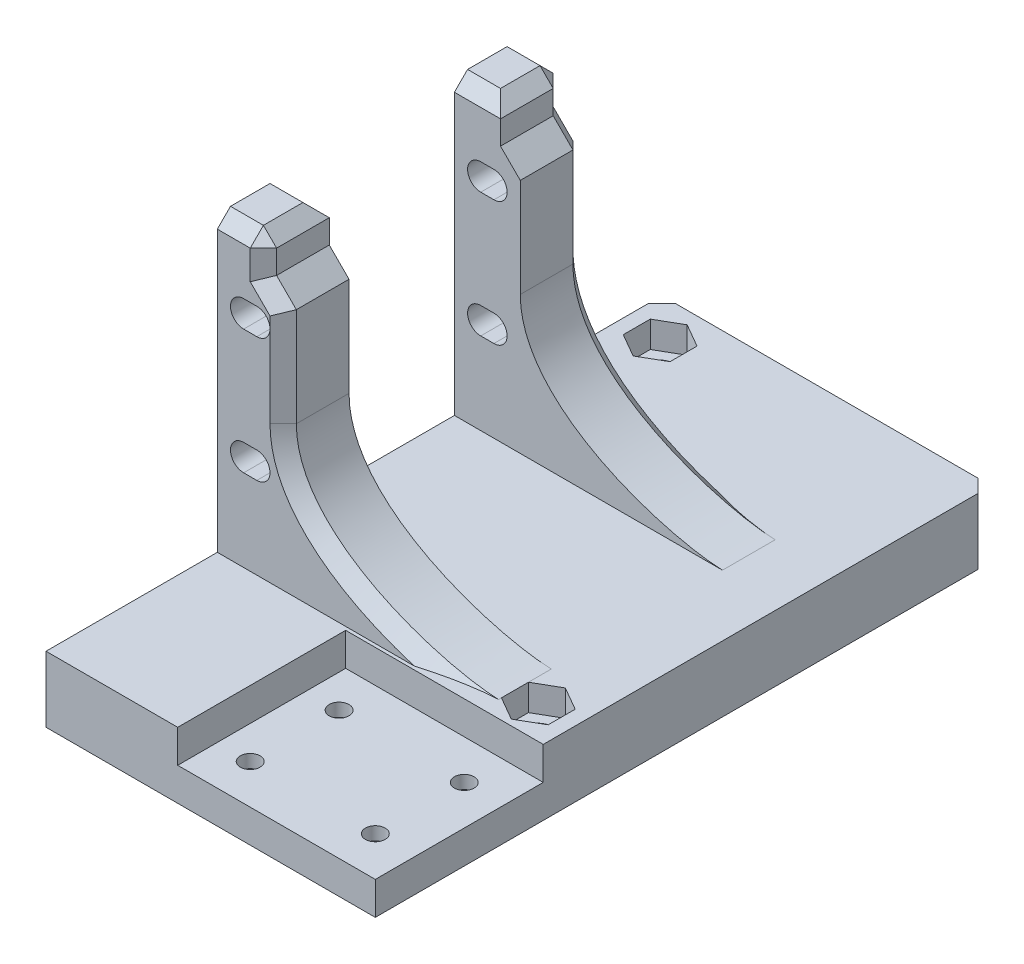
SolidWorks part; units mm, degrees
ref_plane "Front Plane" through (0, 0, 0) normal (0, 0, 1) x (1, 0, 0)
ref_plane "Top Plane" through (0, 0, 0) normal (0, 1, 0) x (1, 0, 0)
ref_plane "Right Plane" through (0, 0, 0) normal (1, 0, 0) x (0, 0, -1)
sketch "Sketch1" plane through (0, 0, 0) normal (0, 1, 0) x (1, 0, 0)
  line L1 (-25, -44.5) -> (25, -44.5)
  line L2 (-25, -44.5) -> (-25, 44.5)
  line L3 (-25, 44.5) -> (25, 44.5)
  line L4 (25, -44.5) -> (25, 44.5)
  line L5 (-25, -44.5) -> (25, 44.5) construction
  line L6 (-25, 44.5) -> (25, -44.5) construction
  point P0 (0, 0)
  dimension "D1" = 89
  dimension "D2" = 50
extrude "Boss-Extrude1" add sketch "Sketch1" along normal blind 10
sketch "Sketch8" plane through (0, 0, 0) normal (0, -1, 0) x (1, 0, 0)
  circle A0 centre (-19.25, -38.4881) radius 2
  circle A1 centre (19.25, 18.5119) radius 2
  dimension "D1" = 4
  dimension "D2" = 4
extrude "Cut-Extrude3" cut sketch "Sketch8" against normal through all
sketch "Sketch9" plane through (0, 10, 0) normal (0, 1, 0) x (1, 0, 0)
  line L0 (-25, 44.5) -> (-25, -44.5) construction
  line L1 (-22.8, 40.5377) -> (-22.8, 36.4385)
  line L2 (-22.8, 36.4385) -> (-19.25, 34.3889)
  line L3 (-19.25, 34.3889) -> (-15.7, 36.4385)
  line L4 (-15.7, 36.4385) -> (-15.7, 40.5377)
  line L5 (-15.7, 40.5377) -> (-19.25, 42.5873)
  line L6 (-19.25, 42.5873) -> (-22.8, 40.5377)
  line L7 (25, -44.5) -> (25, 44.5) construction
  line L8 (22.8, -20.5615) -> (22.8, -16.4623)
  line L9 (22.8, -16.4623) -> (19.25, -14.4127)
  line L10 (19.25, -14.4127) -> (15.7, -16.4623)
  line L11 (15.7, -16.4623) -> (15.7, -20.5615)
  line L12 (15.7, -20.5615) -> (19.25, -22.6111)
  line L13 (19.25, -22.6111) -> (22.8, -20.5615)
  circle A0 centre (-19.25, 38.4881) radius 3.55 construction
  circle A1 centre (19.25, -18.5119) radius 3.55 construction
  dimension "D1" = 7.1
  dimension "D2" = 7.1
extrude "Cut-Extrude4" cut sketch "Sketch9" against normal blind 4
chamfer "Chamfer1" distance 2 angle 45 2 edges at (25, 5, -44.5) (-25, 5, -44.5)
ref_plane "Plane1" through (0, 0, -23) normal (0, 0, -1) x (-1, 0, 0)
sketch "Sketch11" plane through (0, 0, -23) normal (0, 0, -1) x (-1, 0, 0)
  line L0 (25, 10) -> (-15.7, 10)
  line L1 (25, 10) -> (25, 54.5)
  line L3 (15, 45.9078) -> (18, 48.9078)
  line L4 (15, 45.9078) -> (15, 30.9078)
  line L5 (18, 48.9078) -> (18, 54.5)
  line L6 (18, 54.5) -> (25, 54.5)
  line L7 (15, 21.9078) -> (15, 45.9078) construction
  line L8 (25, 67.9061) -> (25, 47.5789) construction
  spline S0 degree 3 poles (15, 30.9078) (15, 16.9598) (-6.6957, 10.3394) (-15.7, 10) knots 0 0 0 0 1 1 1 1
  dimension "D1" = 15
  dimension "D2" = 44.5
extrude "Boss-Extrude2" add sketch "Sketch11" against normal blind 10
sketch "Sketch12" plane through (0, 0, -13) normal (0, 0, 1) x (1, 0, 0)
  line L0 (-18, 43.3578) -> (-22, 43.3578) construction
  line L1 (-18, 24.4578) -> (-22, 24.4578) construction
  line L2 (-21, 46.9078) -> (-21, 39.8078) construction
  line L3 (-17.9504, 46.9078) -> (-22.0496, 46.9078) construction
  line L4 (-22.0496, 39.8078) -> (-17.9504, 39.8078) construction
  line L5 (-19, 46.9078) -> (-19, 39.8078) construction
  line L6 (-19, 41.3578) -> (-21, 41.3578)
  line L7 (-19, 45.3578) -> (-21, 45.3578)
  line L8 (-20, 39.8078) -> (-20, 28.0078) construction
  line L9 (-17.9504, 28.0078) -> (-22.0496, 28.0078) construction
  line L10 (-20, 33.9078) -> (-15, 33.9078) construction
  line L11 (-15, 45.9078) -> (-15, 30.9078) construction
  line L12 (-19, 26.4578) -> (-21, 26.4578)
  line L15 (-19, 22.4578) -> (-21, 22.4578)
  circle A1 centre (-20, 43.3578) radius 2 construction
  circle A2 centre (-20, 24.4578) radius 2 construction
  arc A3 (-21, 41.3578) -> (-21, 45.3578) centre (-21, 43.3578) cw
  arc A4 (-19, 45.3578) -> (-19, 41.3578) centre (-19, 43.3578) cw
  arc A7 (-19, 22.4578) -> (-19, 26.4578) centre (-19, 24.4578) ccw
  arc A8 (-21, 26.4578) -> (-21, 22.4578) centre (-21, 24.4578) ccw
  point P16 (-20, 43.3578)
  dimension "D1" = 1
  dimension "D3" = 2
  dimension "D4" = 2
  dimension "D2" = 1
extrude "Cut-Extrude5" cut sketch "Sketch12" against normal through all
chamfer "Chamfer2" distance 2 angle 45 7 edges at (-15, 38.4078, -23) (-16.5, 47.4078, -23) (-21.5, 54.5, -23) (-18, 51.7039, -23) (-18, 54.5, -18) (-21.5, 54.5, -13)
mirror "Mirror1" about plane through (0, 0, 0) normal (0, 0, 1) of "Chamfer2", "Cut-Extrude5", "Boss-Extrude2"
sketch "Sketch13" plane through (25, 0, 0) normal (1, 0, 0) x (0, 0, -1)
  line L1 (-44.5, 10) -> (-23.5119, 10)
  line L2 (-44.5, 10) -> (-44.5, 5)
  line L3 (-44.5, 5) -> (-23.5119, 5)
  line L4 (-23.5119, 10) -> (-23.5119, 5)
  line L5 (-22.5119, 0) -> (-22.5119, -20) construction
  line L6 (-44.5, 10) -> (-44.5, 0) construction
  line L7 (-44.5, 10) -> (42.5, 10) construction
  dimension "D1" = 1
  dimension "D3" = 5
extrude "Cut-Extrude6" cut sketch "Sketch13" against normal blind 30
sketch "Sketch14" plane through (0, 0, 44.5) normal (0, 0, 1) x (1, 0, 0)
  line L4 (-25, 0) -> (25, 0)
  line L5 (25, 0) -> (25, 5)
  line L6 (-5, 10) -> (-25, 10)
  line L7 (-25, 10) -> (-25, 0)
  line L8 (-25, 0) -> (25, 0)
  line L9 (25, 0) -> (25, 5)
  line L10 (-5, 10) -> (-25, 10)
  line L11 (-25, 10) -> (-25, 0)
  line L14 (25, 5) -> (-5, 5)
  line L15 (25, 5) -> (-5, 5)
  line L16 (-5, 5) -> (-5, 10)
  line L17 (-5, 5) -> (-5, 10)
  dimension "D1" = 0
extrude "Boss-Extrude3" add sketch "Sketch14" along normal up to surface (4.5119 mm away)
sketch "Sketch17" plane through (0, 5, 0) normal (0, 1, 0) x (1, 0, 0)
  circle A0 centre (19, -29.5119) radius 1.5
  circle A1 centre (19, -43.0119) radius 1.5
  circle A2 centre (0, -43.0119) radius 1.5
  circle A3 centre (0, -29.5119) radius 1.5
  dimension "D1" = 3
extrude "Cut-Extrude7" cut sketch "Sketch17" against normal through all
sketch "Sketch18" plane through (0, 0, 0) normal (0, -1, 0) x (1, 0, 0)
  line L0 (25, 49.0119) -> (25, -42.5) construction
  line L1 (21.75, 31.0996) -> (19, 32.6873)
  line L2 (19, 32.6873) -> (16.25, 31.0996)
  line L3 (16.25, 31.0996) -> (16.25, 27.9242)
  line L4 (16.25, 27.9242) -> (19, 26.3365)
  line L5 (19, 26.3365) -> (21.75, 27.9242)
  line L6 (21.75, 27.9242) -> (21.75, 31.0996)
  line L7 (21.75, 44.5996) -> (19, 46.1873)
  line L8 (19, 46.1873) -> (16.25, 44.5996)
  line L9 (16.25, 44.5996) -> (16.25, 41.4242)
  line L10 (16.25, 41.4242) -> (19, 39.8365)
  line L11 (19, 39.8365) -> (21.75, 41.4242)
  line L12 (21.75, 41.4242) -> (21.75, 44.5996)
  line L13 (2.75, 44.5996) -> (0, 46.1873)
  line L14 (0, 46.1873) -> (-2.75, 44.5996)
  line L15 (-2.75, 44.5996) -> (-2.75, 41.4242)
  line L16 (-2.75, 41.4242) -> (0, 39.8365)
  line L17 (0, 39.8365) -> (2.75, 41.4242)
  line L18 (2.75, 41.4242) -> (2.75, 44.5996)
  line L19 (2.75, 31.0996) -> (0, 32.6873)
  line L20 (0, 32.6873) -> (-2.75, 31.0996)
  line L21 (-2.75, 31.0996) -> (-2.75, 27.9242)
  line L22 (-2.75, 27.9242) -> (0, 26.3365)
  line L23 (0, 26.3365) -> (2.75, 27.9242)
  line L24 (2.75, 27.9242) -> (2.75, 31.0996)
  circle A0 centre (19, 29.5119) radius 2.75 construction
  circle A1 centre (19, 43.0119) radius 2.75 construction
  circle A2 centre (0, 43.0119) radius 2.75 construction
  circle A3 centre (0, 29.5119) radius 2.75 construction
  dimension "D1" = 5.5
extrude "Cut-Extrude8" cut sketch "Sketch18" against normal blind 3 contours L19 L20 L21 L22 L23 L24
